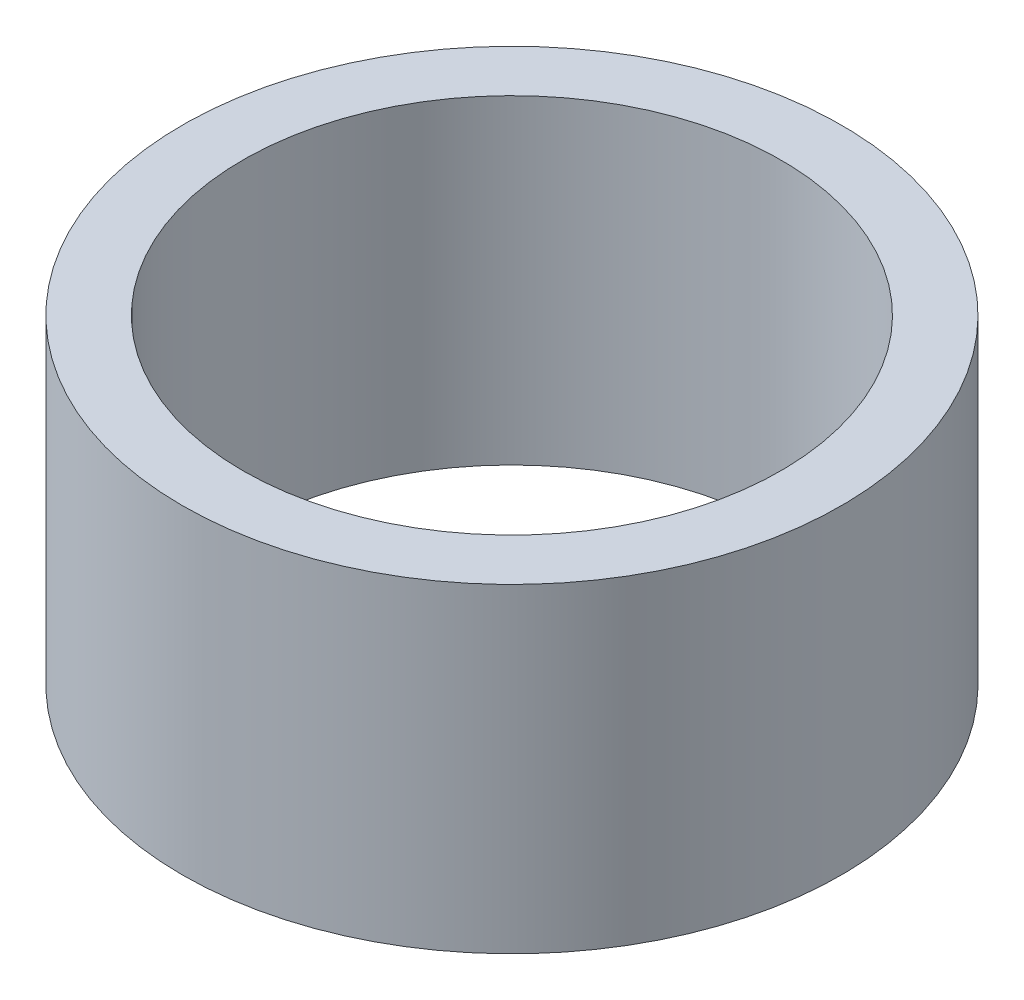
SolidWorks part; units mm, degrees
ref_plane "Front Plane" through (0, 0, 0) normal (0, 0, 1) x (1, 0, 0)
ref_plane "Top Plane" through (0, 0, 0) normal (0, 1, 0) x (1, 0, 0)
ref_plane "Right Plane" through (0, 0, 0) normal (1, 0, 0) x (0, 0, -1)
sketch "Sketch3" plane through (0, 0, 0) normal (0, 1, 0) x (1, 0, 0)
  circle A1 centre (0, 0) radius 34.6075
  circle A2 centre (0, 0) radius 28.2575
  dimension "D1" = 56.515
  dimension "D2" = 69.215
extrude "Boss-Extrude1" add sketch "Sketch3" along normal blind 33.589
